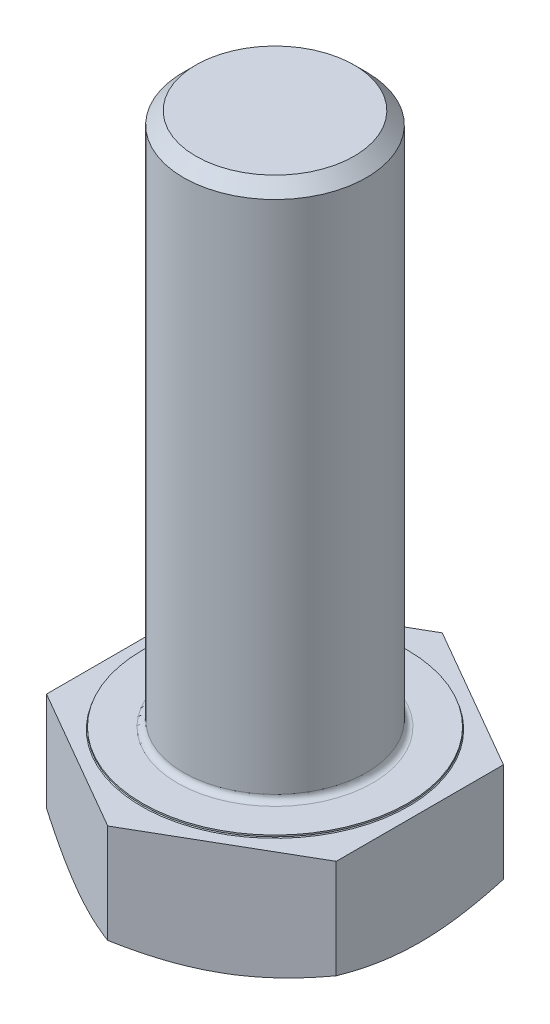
SolidWorks part; units mm, degrees
ref_plane "Plan de face" through (0, 0, 0) normal (0, 0, 1) x (1, 0, 0)
ref_plane "Plan de dessus" through (0, 0, 0) normal (0, 1, 0) x (1, 0, 0)
ref_plane "Plan de droite" through (0, 0, 0) normal (1, 0, 0) x (0, 0, -1)
imported_body "Importée3"
sketch "Esquisse1" plane through (0, -6.6515, 0) normal (0, 1, 0) x (-1, 0, 0)
  line L0 (9.5, 5.4848) -> (9.5, -5.4848)
  line L1 (9.5, -5.4848) -> (0, -10.9697)
  line L2 (0, -10.9697) -> (-9.5, -5.4848)
  line L3 (-9.5, -5.4848) -> (-9.5, 5.4848)
  line L4 (-9.5, 5.4848) -> (0, 10.9697)
  line L5 (0, 10.9697) -> (9.5, 5.4848)
extrude "Boss.-Extru.1" add sketch "Esquisse1" along normal blind 6.5015
sketch "Esquisse2" plane through (0, 0, 0) normal (0, 0, 1) x (1, 0, 0)
  line L0 (6, 35) -> (0, 35)
  line L1 (0, 35) -> (0, -0.15)
  line L2 (0, -0.15) -> (8.7, -0.15)
  line L3 (8.7, -0.15) -> (8.7, 0)
  line L4 (8.7, 0) -> (6, 0)
  line L5 (6, 0) -> (6, 35)
  line L6 (0, 35) -> (0, -0.15) construction
revolve "Révolution1" add sketch "Esquisse2" angle 360 about L6
chamfer "Chanfrein1" distance 0.8119 angle 45 1 edges at (0, 35, -6)
chamfer "Chanfrein2" distance 0.05 angle 45 1 edges at (0, -0.15, -8.7)
fillet "Congé1" radius 0.4 1 edges at (0, 0, -6)
